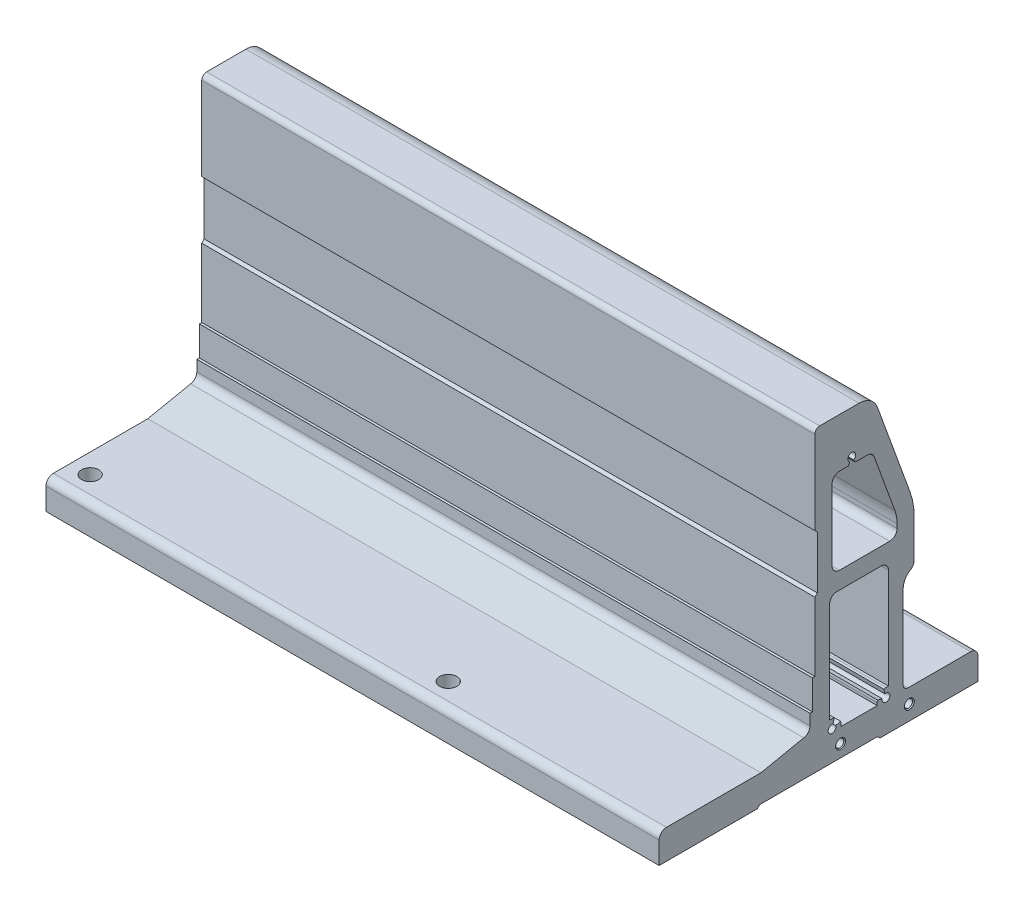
SolidWorks part; units mm, degrees
ref_plane "정면" through (0, 0, 0) normal (0, 0, 1) x (1, 0, 0)
ref_plane "윗면" through (0, 0, 0) normal (0, 1, 0) x (1, 0, 0)
ref_plane "우측면" through (0, 0, 0) normal (1, 0, 0) x (0, 0, -1)
sketch "스케치1" plane through (0, 0, 0) normal (1, 0, 0) x (0, 0, -1)
  line L0 (16.5142, 121.5) -> (0.5, 121.5)
  line L1 (-1.5, 119.5) -> (-1.5, 85.5)
  line L2 (-1.5, 85.5) -> (-0.5, 84.5)
  line L3 (-0.5, 84.5) -> (-0.5, 63)
  line L4 (-0.5, 63) -> (-1.5, 62)
  line L5 (-1.5, 62) -> (-1.5, 34)
  line L6 (-1.5, 34) -> (-2.5, 34)
  line L7 (-2.5, 34) -> (-2.5, 22)
  line L8 (-2.5, 22) -> (-3.5, 22)
  line L9 (-3.5, 22) -> (-3.5, 17.5661)
  line L10 (-6.0351, 14.6023) -> (-23.5, 11)
  line L11 (-23.5, 11) -> (-62, 11)
  line L12 (-65, 8) -> (-65, -1)
  line L13 (-65, -1) -> (-25, -1)
  line L14 (-25, -1) -> (-24, 0)
  line L15 (-24, 0) -> (24, 0)
  line L16 (24, 0) -> (25, -1)
  line L17 (25, -1) -> (65, -1)
  line L18 (65, -1) -> (65, 8)
  line L19 (62, 11) -> (36.5, 11)
  line L20 (34.5, 13) -> (34.5, 47)
  line L21 (39, 54.7942) -> (39, 69.8213)
  line L22 (37.1908, 80.0819) -> (24.0317, 116.2362)
  line L23 (25.5, 59.5) -> (7.5, 59.5)
  line L24 (4.5, 56.5) -> (4.5, 15.6)
  line L25 (4.5, 15.6) -> (5.5, 15.6)
  line L26 (6.4317, 15.4773) -> (5.9141, 13.5455)
  line L27 (7.0455, 12.4141) -> (8.9773, 12.9317)
  line L28 (9.1, 12) -> (9.1, 11)
  line L29 (9.1, 11) -> (23.9, 11)
  line L30 (23.9, 11) -> (23.9, 12)
  line L31 (24.0227, 12.9317) -> (25.9545, 12.4141)
  line L32 (27.0859, 13.5455) -> (26.5683, 15.4773)
  line L33 (27.5, 15.6) -> (28.5, 15.6)
  line L34 (28.5, 15.6) -> (28.5, 56.5)
  line L35 (12.7, 102.6144) -> (12.0566, 101.5)
  line L36 (12.0566, 101.5) -> (8.5, 101.5)
  line L37 (5.5, 98.5) -> (5.5, 69.5)
  line L38 (8.5, 66.5) -> (29, 66.5)
  line L39 (32, 69.5) -> (32, 71.2319)
  line L40 (31.0954, 76.3622) -> (22.6644, 99.5261)
  line L41 (19.8454, 101.5) -> (14.9434, 101.5)
  line L42 (14.9434, 101.5) -> (14.3, 102.6144)
  arc A0 (0.5, 121.5) -> (-1.5, 119.5) centre (0.5, 119.5) ccw
  arc A1 (-6.0351, 14.6023) -> (-3.5, 17.5661) centre (-6.5, 17.5661) ccw
  arc A2 (-62, 11) -> (-65, 8) centre (-62, 8) ccw
  arc A3 (65, 8) -> (62, 11) centre (62, 8) ccw
  arc A4 (34.5, 13) -> (36.5, 11) centre (36.5, 13) ccw
  arc A5 (37.5, 52.1962) -> (34.5, 47) centre (40.5, 47) ccw
  arc A6 (37.5, 52.1962) -> (39, 54.7942) centre (36, 54.7942) ccw
  arc A7 (39, 69.8213) -> (37.1908, 80.0819) centre (9, 69.8213) ccw
  arc A8 (24.0317, 116.2362) -> (16.5142, 121.5) centre (16.5142, 113.5) ccw
  arc A9 (7.5, 59.5) -> (4.5, 56.5) centre (7.5, 56.5) ccw
  arc A10 (6.4317, 15.4773) -> (5.5, 15.6) centre (5.5, 12) ccw
  arc A11 (5.9141, 13.5455) -> (7.0455, 12.4141) centre (5.5, 12) ccw
  arc A12 (9.1, 12) -> (8.9773, 12.9317) centre (5.5, 12) ccw
  arc A13 (24.0227, 12.9317) -> (23.9, 12) centre (27.5, 12) ccw
  arc A14 (25.9545, 12.4141) -> (27.0859, 13.5455) centre (27.5, 12) ccw
  arc A15 (27.5, 15.6) -> (26.5683, 15.4773) centre (27.5, 12) ccw
  arc A16 (28.5, 56.5) -> (25.5, 59.5) centre (25.5, 56.5) ccw
  arc A17 (14.3, 102.6144) -> (12.7, 102.6144) centre (13.5, 104) ccw
  arc A18 (8.5, 101.5) -> (5.5, 98.5) centre (8.5, 98.5) ccw
  arc A19 (5.5, 69.5) -> (8.5, 66.5) centre (8.5, 69.5) ccw
  arc A20 (29, 66.5) -> (32, 69.5) centre (29, 69.5) ccw
  arc A21 (32, 71.2319) -> (31.0954, 76.3622) centre (17, 71.2319) ccw
  arc A22 (22.6644, 99.5261) -> (19.8454, 101.5) centre (19.8454, 98.5) ccw
extrude "보스-돌출1" add sketch "스케치1" along normal mid plane 250
hole_wizard "M5 소켓 머리 캡 나사용 카운터보어1" positions "스케치2" profile "스케치3" counterbore size "M5" standard "KS"
sketch "스케치2" plane through (0, 0, -39) normal (0, 0, -1) x (-1, 0, 0)
  line L0 (-125, 80.0819) -> (-125, 116.2362) construction
  line L1 (-125, -1) -> (125, -1) construction
  point P0 (-100, 97)
  point P2 (-70, 97)
  point P4 (-40, 97)
  point P6 (-100, 45)
  point P8 (-70, 45)
  point P10 (-40, 45)
  dimension "D1" = 25
  dimension "D2" = 30
  dimension "D3" = 30
  dimension "D4" = 52
  dimension "D5" = 46
sketch "스케치3" plane through (100, 97, -39) normal (1, 0, 0) x (0, 1, 0)
  line L0 (0, 0) -> (0, 11.6524)
  line L1 (0, 11.6524) -> (2.75, 10)
  line L2 (2.75, 10) -> (2.75, 34.5)
  line L3 (2.75, 34.5) -> (4.75, 34.5)
  line L4 (4.75, 34.5) -> (4.75, 0)
  line L5 (4.75, 0) -> (0, 0)
  line L10 (0, 11.6524) -> (-2.75, 10) construction
  line L11 (0, -6.35) -> (0, 107.95) construction
  dimension "구멍 지름" = 5.5
  dimension "구멍 깊이" = 10
  dimension "카운터보어 지름" = 9.5
  dimension "카운터보어 깊이" = 34.5
  dimension "드릴 각도" = 118
pattern_linear "선형 패턴1" count 2 spacing 140 along (-1, 0, 0) of "M5 소켓 머리 캡 나사용 카운터보어1"
hole_wizard "M4 나사 구멍1" positions "스케치6" profile "스케치5" tap size "M4" standard "ISO"
sketch "스케치6" plane through (125, 0, 0) normal (1, 0, 0) x (0, 0, -1)
  line L0 (65, -1) -> (65, 8) construction
  line L1 (25, -1) -> (65, -1) construction
  point P0 (9, 5)
  point P2 (37, 5)
  dimension "D1" = 28
  dimension "D2" = 28
  dimension "D3" = 6
sketch "스케치5" plane through (125, 5, -9) normal (0, 1, 0) x (0, 0, -1)
  line L0 (0, 0) -> (0, 10.9914)
  line L1 (0, 10.9914) -> (1.65, 10)
  line L2 (1.65, 10) -> (1.65, 0.375)
  line L3 (1.65, 0.375) -> (2.025, 0)
  line L5 (2.025, 0) -> (0, 0)
  line L6 (-1.65, 0.375) -> (-2.025, 0) construction
  line L10 (0, 10.9914) -> (-1.65, 10) construction
  line L11 (0, -6.35) -> (0, 107.95) construction
  dimension "탭 드릴 지름" = 3.3
  dimension "탭 드릴 깊이" = 10
  dimension "표면 카운터싱크 지름" = 4.05
  dimension "표면 카운터싱크 각도" = 90
  dimension "드릴 각도" = 118
hole_wizard "Ø5.0mm 맞춤핀 구멍1" positions "스케치7" profile "스케치8" hole size "Ø5.0" standard "ISO"
sketch "스케치7" plane through (0, 0, 0) normal (0, -1, 0) x (-1, 0, 0)
  line L0 (0, 0) -> (137.7278, 0) construction
  line L1 (125, -24) -> (125, 24) construction
  point P5 (117, 0)
  point P7 (-29, 0)
  dimension "D1" = 146
  dimension "D2" = 8
sketch "스케치8" plane through (29, 0, 0) normal (1, 0, 0) x (0, 0, -1)
  line L0 (0, 0) -> (0, 11.5022)
  line L1 (0, 11.5022) -> (2.5, 10)
  line L2 (2.5, 10) -> (2.5, 0)
  line L5 (2.5, 0) -> (0, 0)
  line L10 (0, 11.5022) -> (-2.5, 10) construction
  line L11 (0, -6.35) -> (0, 107.95) construction
  dimension "구멍 지름" = 5
  dimension "구멍 깊이" = 10
  dimension "드릴 각도" = 118
hole_wizard "Ø7.0 (7) 지름 구멍1" positions "스케치9" profile "스케치10" hole size "Ø7.0" standard "ISO"
sketch "스케치9" plane through (0, -1, 0) normal (0, -1, 0) x (-1, 0, 0)
  line L0 (-125, 65) -> (125, 65) construction
  line L1 (125, -65) -> (125, -25) construction
  point P0 (117, -55)
  point P4 (117, 55)
  point P13 (0, 0)
  point P14 (-29, -55)
  point P15 (-29, 55)
  dimension "D1" = 10
  dimension "D2" = 110
  dimension "D3" = 8
  dimension "D4" = 146
sketch "스케치10" plane through (-117, -1, 55) normal (1, 0, 0) x (0, 0, -1)
  line L0 (0, 0) -> (0, 122.5)
  line L1 (0, 122.5) -> (3.5, 122.5)
  line L2 (3.5, 122.5) -> (3.5, 0)
  line L5 (3.5, 0) -> (0, 0)
  line L11 (0, -6.35) -> (0, 107.95) construction
  dimension "관통 구멍 지름" = 7
  dimension "관통 구멍 깊이" = 122.5
